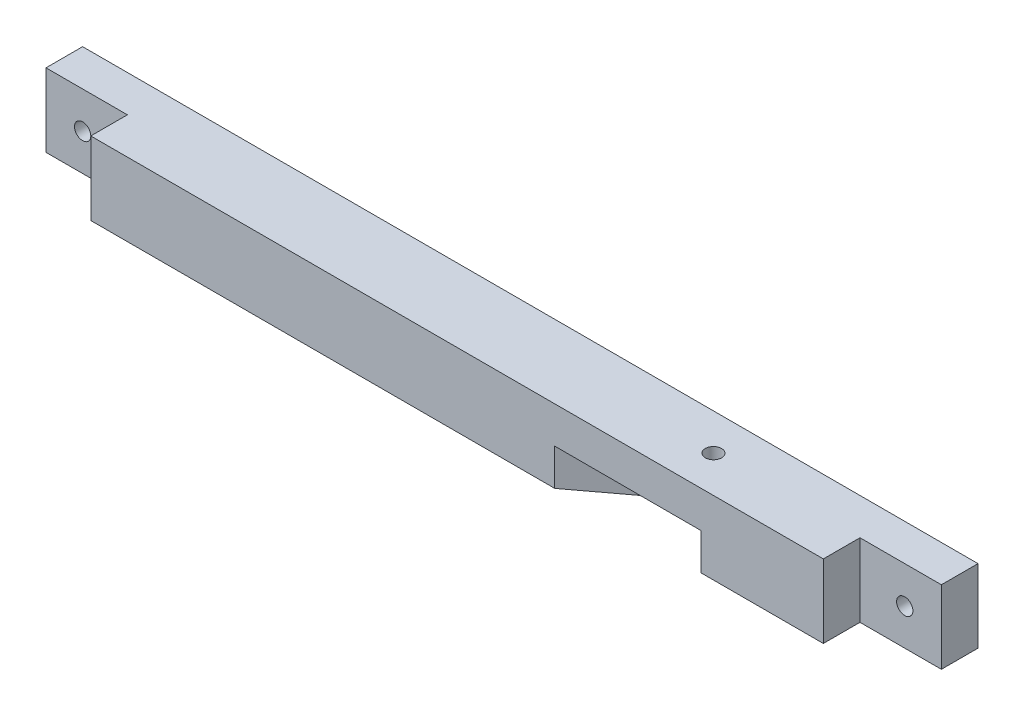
SolidWorks part; units mm, degrees
ref_plane "Face" through (0, 0, 0) normal (0, 0, 1) x (1, 0, 0)
ref_plane "Dessus" through (0, 0, 0) normal (0, 1, 0) x (1, 0, 0)
ref_plane "Droite" through (0, 0, 0) normal (1, 0, 0) x (0, 0, -1)
sketch "Esquisse1" plane through (0, 0, 0) normal (0, 0, 1) x (1, 0, 0)
  line L1 (-67.2717, -109.6176) -> (42.7283, -109.6176)
  line L2 (-67.2717, -109.6176) -> (-67.2717, -100.6176)
  line L3 (-67.2717, -100.6176) -> (42.7283, -100.6176)
  line L4 (42.7283, -109.6176) -> (42.7283, -100.6176)
  dimension "D1" = 110
  dimension "D2" = 9
extrude "Extrusion1" add sketch "Esquisse1" along normal blind 9
sketch "Esquisse2" plane through (0, 0, 9) normal (0, 0, 1) x (1, 0, 0)
  line L0 (42.7283, -100.6176) -> (-67.2717, -100.6176) construction
  line L1 (-67.2717, -109.6176) -> (-57.2717, -109.6176)
  line L2 (-67.2717, -109.6176) -> (-67.2717, -100.6176)
  line L3 (-67.2717, -100.6176) -> (-57.2717, -100.6176)
  line L4 (-57.2717, -109.6176) -> (-57.2717, -100.6176)
  line L6 (42.7283, -109.6176) -> (32.7283, -109.6176)
  line L7 (42.7283, -109.6176) -> (42.7283, -100.6176)
  line L8 (42.7283, -100.6176) -> (32.7283, -100.6176)
  line L9 (32.7283, -109.6176) -> (32.7283, -100.6176)
  dimension "D1" = 10
  dimension "D2" = 10
extrude "Enlèv. mat.-Extru.1" cut sketch "Esquisse2" against normal blind 4.5
sketch "Esquisse4" plane through (0, 0, 4.5) normal (0, 0, 1) x (1, 0, 0)
  line L0 (42.7283, -109.6176) -> (42.7283, -100.6176) construction
  line L1 (32.7283, -109.6176) -> (42.7283, -109.6176) construction
  circle A0 centre (38.2284, -105.1454) radius 1
  point P2 (42.7283, -105.1176)
  point P5 (37.7283, -109.6176)
  dimension "D3" = 2
  dimension "D1" = 4.5
  dimension "D2" = 4.5
extrude "Enlèv. mat.-Extru.2" cut sketch "Esquisse4" against normal blind 4.5
sketch "Esquisse5" plane through (0, 0, 4.5) normal (0, 0, 1) x (1, 0, 0)
  line L0 (-67.2717, -109.6176) -> (-57.2717, -109.6176) construction
  line L1 (-67.2717, -100.6176) -> (-67.2717, -109.6176) construction
  circle A0 centre (-62.7717, -105.1176) radius 1
  dimension "D1" = 2
  dimension "D2" = 4.5
  dimension "D3" = 4.5
extrude "Enlèv. mat.-Extru.3" cut sketch "Esquisse5" against normal blind 4.5
sketch "Esquisse6" plane through (0, -109.6176, 0) normal (0, -1, 0) x (1, 0, 0)
  line L0 (29.7283, 0) -> (17.7283, 9)
  line L1 (-67.2717, 0) -> (42.7283, 0) construction
  line L2 (-57.2717, 9) -> (32.7283, 9) construction
  line L3 (17.7283, 9) -> (-0.2717, 9)
  line L4 (-0.2717, 9) -> (11.7283, 0)
  line L5 (11.7283, 0) -> (29.7283, 0)
  dimension "D1" = 15
  dimension "D2" = 18
  dimension "D3" = 13
  dimension "D4" = 18
extrude "Enlèv. mat.-Extru.4" cut sketch "Esquisse6" against normal blind 4.5
sketch "Esquisse7" plane through (0, -105.1176, 0) normal (0, -1, 0) x (1, 0, 0)
  line L0 (17.7283, 9) -> (11.7283, 0) construction
  line L1 (11.7283, 0) -> (29.7283, 0) construction
  line L2 (29.7283, 0) -> (-0.2717, 9) construction
  line L3 (-0.2717, 9) -> (11.7283, 0) construction
  line L4 (17.7283, 9) -> (-0.2717, 9) construction
  circle A0 centre (14.7283, 4.5) radius 1
  dimension "D1" = 2
extrude "Enlèv. mat.-Extru.5" cut sketch "Esquisse7" against normal blind 4.5
